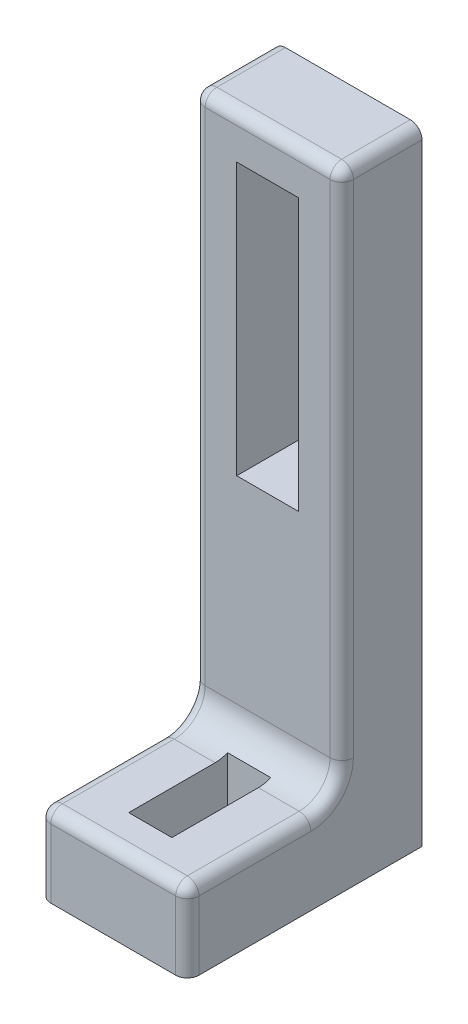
SolidWorks part; units mm, degrees
ref_plane "Front Plane" through (0, 0, 0) normal (0, 0, 1) x (1, 0, 0)
ref_plane "Top Plane" through (0, 0, 0) normal (0, 1, 0) x (1, 0, 0)
ref_plane "Right Plane" through (0, 0, 0) normal (1, 0, 0) x (0, 0, -1)
sketch "Sketch4" plane through (0, 0, 0) normal (1, 0, 0) x (0, 0, -1)
  line L0 (-22.5, 125.3375) -> (-22.5, -35)
  line L1 (-22.5, -35) -> (-82.825, -35)
  line L2 (-82.825, -35) -> (-82.825, -14.3625)
  line L3 (-82.825, -14.3625) -> (-43.1375, -14.3625)
  line L4 (-43.1375, -14.3625) -> (-43.1375, 125.3375)
  line L5 (-43.1375, 125.3375) -> (-22.5, 125.3375)
  dimension "D1" = 60.325
  dimension "D2" = 20.6375
  dimension "D3" = 160.3375
  dimension "D4" = 22.5
  dimension "D5" = 35
extrude "Boss-Extrude5" add sketch "Sketch4" along normal mid plane 38.1 separate body
sketch "Sketch8" plane through (0, 0, 43.1375) normal (0, 0, 1) x (1, 0, 0)
  line L0 (19.05, 125.3375) -> (-19.05, 125.3375) construction
  line L1 (-7.9375, 114.225) -> (7.9375, 114.225)
  line L2 (-7.9375, 114.225) -> (-7.9375, 44.375)
  line L3 (-7.9375, 44.375) -> (7.9375, 44.375)
  line L4 (7.9375, 114.225) -> (7.9375, 44.375)
  line L5 (0, 114.225) -> (0, 125.3375) construction
  dimension "D1" = 11.1125
  dimension "D2" = 15.875
  dimension "D3" = 69.85
extrude "Cut-Extrude1" cut sketch "Sketch8" against normal blind 15.875
sketch "Sketch9" plane through (0, -14.3625, 0) normal (0, 1, 0) x (1, 0, 0)
  line L0 (0, -73.3) -> (0, -82.825) construction
  line L1 (-5.5562, -73.3) -> (5.5563, -73.3)
  line L2 (-5.5562, -73.3) -> (-5.5562, -47.9)
  line L3 (-5.5562, -47.9) -> (5.5562, -47.9)
  line L4 (5.5563, -73.3) -> (5.5562, -47.9)
  line L5 (19.05, -82.825) -> (-19.05, -82.825) construction
  dimension "D1" = 9.525
  dimension "D2" = 11.1125
  dimension "D3" = 25.4
extrude "Cut-Extrude2" cut sketch "Sketch9" against normal through all
fillet "Fillet1" radius 7.9375 1 edges at (0, -14.3625, 43.1375)
fillet "Fillet2" radius 3 4 edges at (-19.05, 125.3375, 32.8188) (19.05, 125.3375, 32.8188) (-19.05, -24.6813, 82.825) (19.05, -24.6813, 82.825)
fillet "Fillet3" radius 3 12 edges at (18.1713, 124.4588, 43.1375) (19.05, 57.9562, 43.1375) (19.05, -12.0377, 45.4623) (19.05, -14.3625, 65.45) (18.1713, -14.3625, 81.9463) (0, -14.3625, 82.825) (-18.1713, -14.3625, 81.9463) (-19.05, -14.3625, 65.45) (-19.05, -12.0377, 45.4623) (-19.05, 57.9562, 43.1375) (-18.1713, 124.4588, 43.1375) (0, 125.3375, 43.1375)
ref_plane "Plane1" through (0, 0, -17.5) normal (0, 0, -1) x (-1, 0, 0)
